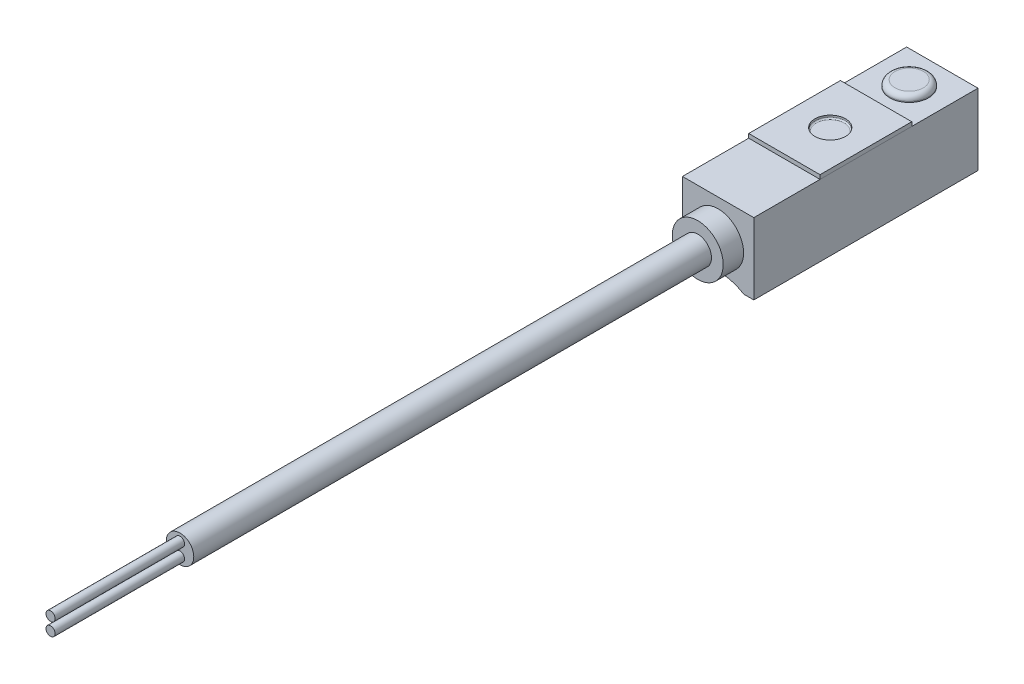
SolidWorks part; units mm, degrees
ref_plane "Front" through (0, 0, 0) normal (0, 0, 1) x (1, 0, 0)
ref_plane "Top" through (0, 0, 0) normal (0, 1, 0) x (1, 0, 0)
ref_plane "Right" through (0, 0, 0) normal (1, 0, 0) x (0, 0, -1)
sketch "Sketch1" plane through (0, 0, 0) normal (0, 0, 1) x (1, 0, 0)
  line L0 (2.5131, -3.5) -> (3.5, -3.5)
  line L1 (-3.5, 3.5) -> (3.5, 3.5)
  line L2 (-3.5, 3.5) -> (-3.5, -3.5)
  line L3 (-3.5, -3.5) -> (-2.5131, -3.5)
  line L4 (3.5, 3.5) -> (3.5, -3.5)
  arc A0 (2.5131, -3.5) -> (-2.5131, -3.5) centre (0, -7.62) ccw
  dimension "D6" = 9.652
  dimension "D1" = 7
  dimension "D2" = 7
  dimension "D3" = 3.5
  dimension "D4" = 3.5
  dimension "D5" = 7.62
extrude "Extrude1" add sketch "Sketch1" along normal blind 22
sketch "Sketch2" plane through (0, 0, 22) normal (0, 0, 1) x (1, 0, 0)
  circle A0 centre (0, 0) radius 2.5
  dimension "D1" = 5
extrude "Extrude2" add sketch "Sketch2" along normal blind 2
sketch "Sketch3" plane through (0, 3.5, 0) normal (0, 1, 0) x (1, 0, 0)
  line L0 (-3.5, -22) -> (-3.5, 0) construction
  line L1 (-3.5, -6.5) -> (3.5, -6.5)
  line L2 (-3.5, -6.5) -> (-3.5, -15.5)
  line L3 (-3.5, -15.5) -> (3.5, -15.5)
  line L4 (3.5, -6.5) -> (3.5, -15.5)
  line L5 (3.5, -22) -> (3.5, 0) construction
  line L6 (3.5, 0) -> (-3.5, 0) construction
  dimension "D1" = 6.5
  dimension "D2" = 9
extrude "Extrude3" add sketch "Sketch3" along normal blind 0.4 separate body
sketch "Sketch4" plane through (0, 3.9, 0) normal (0, 1, 0) x (1, 0, 0)
  line L0 (3.5, -6.5) -> (-3.5, -6.5) construction
  circle A0 centre (0, -11) radius 1.5
  dimension "D2" = 3
  dimension "D1" = 4.5
extrude "Extrude4" cut sketch "Sketch4" against normal blind 0.3
sketch "Sketch5" plane through (0, 3.5, 0) normal (0, 1, 0) x (1, 0, 0)
  line L0 (3.5, 0) -> (-3.5, 0) construction
  circle A0 centre (0, -3.25) radius 1.9
  dimension "D1" = 3.8
  dimension "D2" = 3.25
extrude "Extrude5" add sketch "Sketch5" along normal blind 0.6
fillet "Fillet1" radius 0.508 1 edges at (0, 4.1, 5.15)
fillet "Fillet2" radius 0.127 1 edges at (0, 3.6, 12.5)
sketch "Sketch6" plane through (0, 0, 24) normal (0, 0, 1) x (1, 0, 0)
  circle A0 centre (0, 0) radius 1.35
  dimension "D1" = 2.7
extrude "Extrude6" add sketch "Sketch6" along normal blind 50.8
sketch "Sketch7" plane through (0, 0, 74.8) normal (0, 0, 1) x (1, 0, 0)
  circle A0 centre (0, 0.635) radius 0.45
  circle A1 centre (0, -0.635) radius 0.45
  dimension "D1" = 0.9
  dimension "D2" = 1.27
  dimension "D3" = 0.635
extrude "Extrude7" add sketch "Sketch7" along normal blind 12.7
sketch "Sketch8" plane through (0, 0, 0) normal (1, 0, 0) x (0, 0, -1)
  line L0 (-24, 2.5) -> (-24, -2.5) construction
  spline S0 degree 3 poles (-24, 0) (-25.6625, -0.0835) (-29.2527, -0.2638) (-33.0915, 4.6817) (-37.266, 4.6289) (-39.5081, 4.6006) knots 0 0 0 0 0.285302 0.616135 1 1 1 1
sketch "Sketch9" plane through (0, 0, 24) normal (0, 0, 1) x (1, 0, 0)
  circle A1 centre (0, 0) radius 1.35
  circle A2 centre (0, 0) radius 2.5 construction
  dimension "D1" = 2.7
sweep "Web feature 1" [suppressed] add profiles "Sketch9" path "Sketch8"
